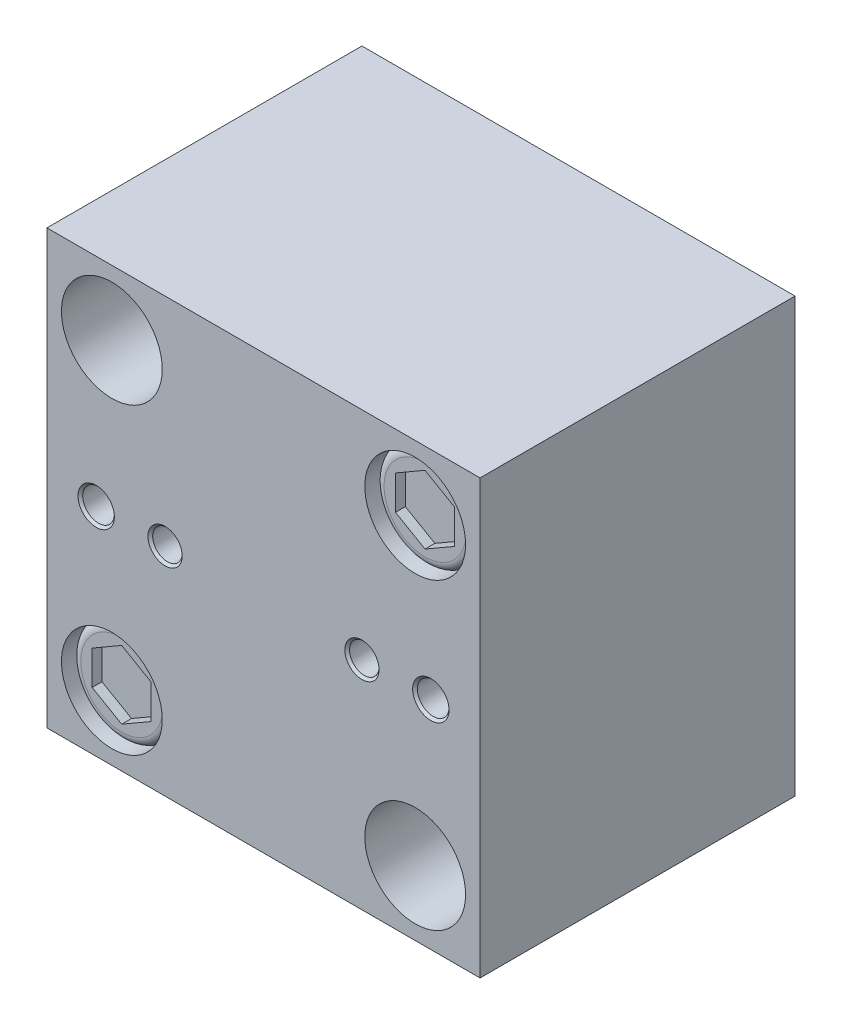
SolidWorks part; units mm, degrees
ref_plane "Front Plane" through (0, 0, 0) normal (0, 0, 1) x (1, 0, 0)
ref_plane "Top Plane" through (0, 0, 0) normal (0, 1, 0) x (1, 0, 0)
ref_plane "Right Plane" through (0, 0, 0) normal (1, 0, 0) x (0, 0, -1)
sketch "Sketch1" plane through (0, 0, 0) normal (0, 0, 1) x (1, 0, 0)
  line L0 (-34.925, 34.925) -> (34.925, -34.925) construction
  line L1 (-34.925, 34.925) -> (34.925, 34.925)
  line L2 (-34.925, 34.925) -> (-34.925, -34.925)
  line L3 (-34.925, -34.925) -> (34.925, -34.925)
  line L4 (34.925, 34.925) -> (34.925, -34.925)
  dimension "D1" = 69.85
  dimension "D2" = 69.85
extrude "Extrude1" add sketch "Sketch1" along normal blind 50.8
sketch "Sketch2" plane through (0, 0, 50.8) normal (0, 0, 1) x (1, 0, 0)
  line L0 (-24.4602, 24.4602) -> (24.4602, -24.4602) construction
  circle A0 centre (-24.4602, 24.4602) radius 8.128
  circle A1 centre (24.4602, 24.4602) radius 8.128
  circle A2 centre (-24.4602, -24.4602) radius 8.128
  circle A3 centre (24.4602, -24.4602) radius 8.128
  dimension "D1" = 16.256
  dimension "D2" = 48.9204
  dimension "D3" = 48.9204
extrude "Cut-Extrude1" cut sketch "Sketch2" against normal through all
hole_wizard "Hole1" positions "Sketch4" profile "Sketch3" legacy
sketch "Sketch4" plane through (0, 0, 0) normal (0, 0, -1) x (-1, 0, 0)
  line L0 (-15.875, 0) -> (15.875, 0) construction
  point P0 (-15.875, 0)
  point P2 (15.875, 0)
  dimension "D1" = 31.75
sketch "Sketch3" plane through (15.875, 0, 0) normal (1, 0, 0) x (0, 1, 0)
  line L0 (0, 0) -> (0, 50.8)
  line L1 (0, 50.8) -> (2.3813, 50.8)
  line L2 (2.3813, 50.8) -> (2.3813, 38.1)
  line L3 (2.3813, 38.1) -> (2.9845, 38.1)
  line L4 (2.9845, 38.1) -> (2.9845, 0)
  line L5 (2.9845, 0) -> (0, 0)
  line L6 (0, 110) -> (0, -10) construction
  dimension "Diameter" = 4.7625
  dimension "Depth" = 50.8
  dimension "C-Bore Diameter" = 5.969
  dimension "C-Bore Depth" = 38.1
hole_wizard "1/4-20 Tapped Hole1" positions "Sketch6" profile "Sketch5" tap size "1/4-20" standard "ANSI Inch"
sketch "Sketch6" plane through (0, 0, 50.8) normal (0, 0, 1) x (1, 0, 0)
  line L0 (-26.9875, 0) -> (26.9875, 0) construction
  point P4 (-26.9875, 0)
  point P6 (26.9875, 0)
  dimension "D1" = 53.975
sketch "Sketch5" plane through (-26.9875, 0, 50.8) normal (1, 0, 0) x (0, -1, 0)
  line L0 (0, 0) -> (0, 26.9338)
  line L1 (0, 26.9338) -> (2.5527, 25.4)
  line L2 (2.5527, 25.4) -> (2.5527, 0)
  line L5 (2.5527, 0) -> (0, 0)
  line L10 (0, 26.9338) -> (-2.5527, 25.4) construction
  line L11 (0, -6.35) -> (0, 107.95) construction
  dimension "Tap Drill Dia." = 5.1054
  dimension "Tap Drill Depth" = 25.4
  dimension "Drill Angle" = 118
sketch "Sketch7" plane through (0, 0, 0) normal (0, 0, -1) x (-1, 0, 0)
  circle A4 centre (-24.4602, 24.4602) radius 8.128 construction
  circle A5 centre (-24.4602, 24.4602) radius 8.128
  circle A6 centre (24.4602, -24.4602) radius 8.128 construction
  circle A7 centre (24.4602, -24.4602) radius 8.128
extrude "Boss-Extrude1" add sketch "Sketch7" against normal offset from surface (49.2125 mm away) 1.5875 separate body
fillet "Fillet1" radius 1.524 1 edges at (32.5882, 24.4602, 49.2125)
fillet "Fillet2" radius 1.524 1 edges at (-16.3322, -24.4602, 49.2125)
sketch "Sketch8" plane through (0, 0, 49.2125) normal (0, 0, 1) x (1, 0, 0)
  line L1 (24.4602, 29.9595) -> (19.6977, 27.2098)
  line L2 (19.6977, 27.2098) -> (19.6977, 21.7106)
  line L3 (19.6977, 21.7106) -> (24.4602, 18.9609)
  line L4 (24.4602, 18.9609) -> (29.2227, 21.7106)
  line L5 (29.2227, 21.7106) -> (29.2227, 27.2098)
  line L6 (29.2227, 27.2098) -> (24.4602, 29.9595)
  line L7 (-24.4602, -18.9609) -> (-29.2227, -21.7106)
  line L8 (-29.2227, -21.7106) -> (-29.2227, -27.2098)
  line L9 (-29.2227, -27.2098) -> (-24.4602, -29.9595)
  line L10 (-24.4602, -29.9595) -> (-19.6977, -27.2098)
  line L11 (-19.6977, -27.2098) -> (-19.6977, -21.7106)
  line L12 (-19.6977, -21.7106) -> (-24.4602, -18.9609)
  circle A0 centre (24.4602, 24.4602) radius 4.7625 construction
  circle A1 centre (-24.4602, -24.4602) radius 4.7625 construction
  circle A2 centre (24.4602, 24.4602) radius 6.604 construction
  circle A3 centre (-24.4602, -24.4602) radius 6.604 construction
  dimension "D1" = 9.525
extrude "Cut-Extrude2" cut sketch "Sketch8" against normal blind 1.5875
chamfer "Chamfer1" distance 0.381 angle 45 4 edges at (29.5402, 0, 50.8) (-18.2563, 0, 50.8) (-24.4348, 0, 50.8) (13.4937, 0, 50.8)
